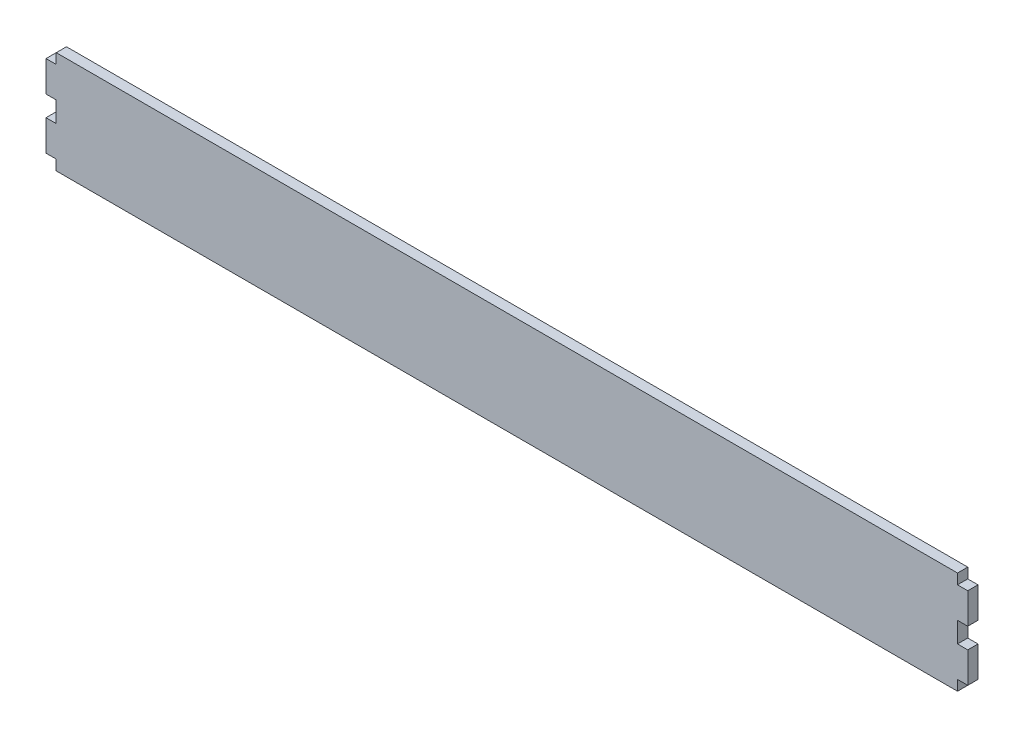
SolidWorks part; units mm, degrees
ref_plane "Front Plane" through (0, 0, 0) normal (0, 0, 1) x (1, 0, 0)
ref_plane "Top Plane" through (0, 0, 0) normal (0, 1, 0) x (1, 0, 0)
ref_plane "Right Plane" through (0, 0, 0) normal (1, 0, 0) x (0, 0, -1)
sketch "Model" plane through (0, 0, 0) normal (0, 0, 1) x (1, 0, 0)
  line L0 (-220, -25) -> (220, -25)
  line L1 (-220, -20) -> (-220, -25)
  line L2 (-225, -20) -> (-220, -20)
  line L3 (-225, -5) -> (-225, -20)
  line L4 (-220, -5) -> (-225, -5)
  line L5 (-220, 5) -> (-220, -5)
  line L6 (-225, 5) -> (-220, 5)
  line L7 (-225, 20) -> (-225, 5)
  line L8 (-220, 20) -> (-225, 20)
  line L9 (-220, 25) -> (-220, 20)
  line L10 (220, 25) -> (-220, 25)
  line L11 (220, 20) -> (220, 25)
  line L12 (225, 20) -> (220, 20)
  line L13 (225, 5) -> (225, 20)
  line L14 (220, -5) -> (220, 5)
  line L15 (220, -25) -> (220, -20)
  line L16 (225, -5) -> (220, -5)
  line L17 (225, -20) -> (225, -5)
  line L18 (220, -20) -> (225, -20)
  line L19 (220, 5) -> (225, 5)
extrude "Boss-Extrude1" add sketch "Model" along normal blind 5 contours L10 L9 L8 L7 L6 L5 L4 L3 L2 L1 L0 L15 L18 L17 L16 L14 L19 L13 L12 L11
